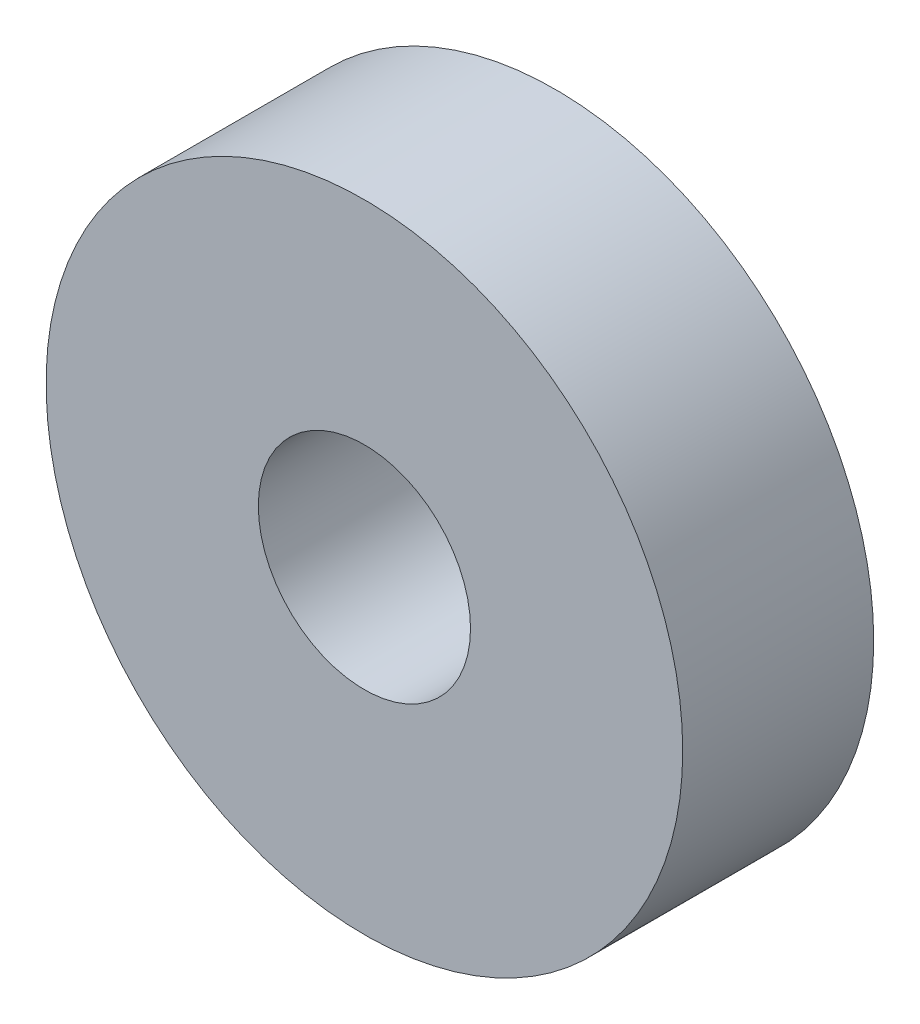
SolidWorks part; units mm, degrees
ref_plane "前视基准面" through (0, 0, 0) normal (0, 0, 1) x (1, 0, 0)
ref_plane "上视基准面" through (0, 0, 0) normal (0, 1, 0) x (1, 0, 0)
ref_plane "右视基准面" through (0, 0, 0) normal (1, 0, 0) x (0, 0, -1)
sketch "草图1" plane through (0, 0, 0) normal (0, 0, 1) x (1, 0, 0)
  circle A0 centre (0, 0) radius 0.5
  circle A1 centre (0, 0) radius 1.5
  dimension "D1" = 1
  dimension "D2" = 3
extrude "凸台-拉伸1" add sketch "草图1" along normal blind 0.9
